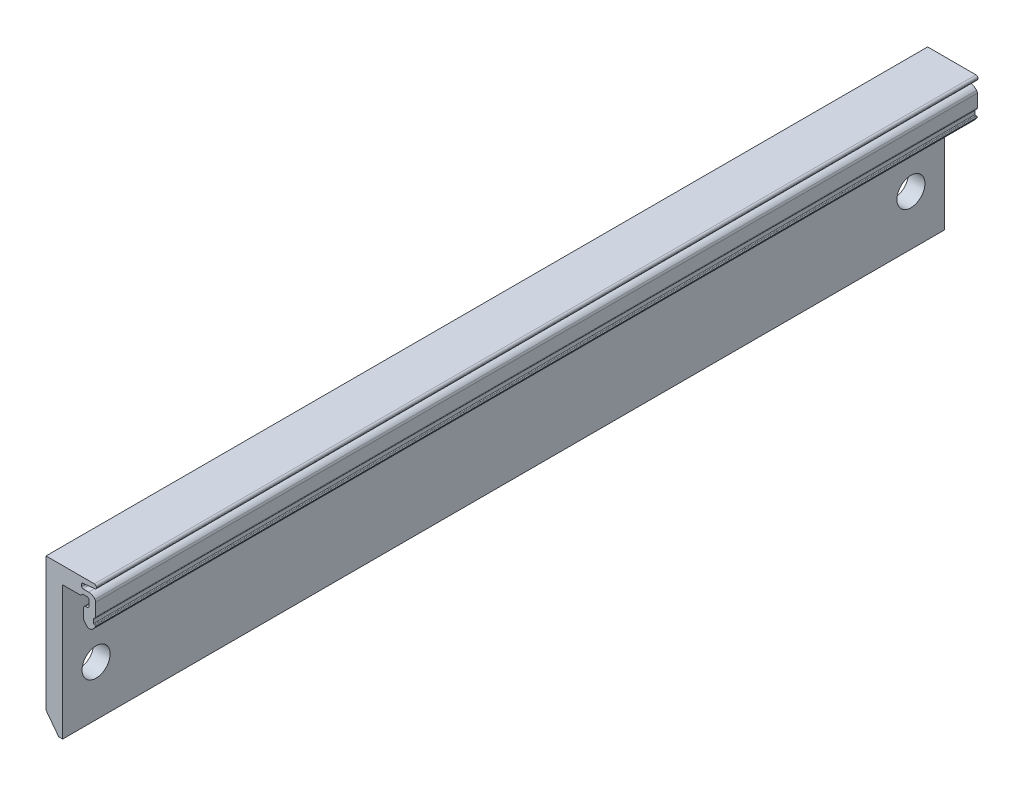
SolidWorks part; units mm, degrees
ref_plane "前视基准面" through (0, 0, 0) normal (0, 0, 1) x (1, 0, 0)
ref_plane "上视基准面" through (0, 0, 0) normal (0, 1, 0) x (1, 0, 0)
ref_plane "右视基准面" through (0, 0, 0) normal (1, 0, 0) x (0, 0, -1)
sketch "草图1" plane through (0, 0, 0) normal (0, 0, 1) x (1, 0, 0)
  line L0 (2350.384, -3290.1038) -> (2355.384, -3290.1038)
  line L2 (2352.884, -3292.6038) -> (2355.384, -3292.6038)
  line L3 (2350.384, -3292.6038) -> (2350.384, -3310.1038)
  line L4 (2352.884, -3292.6038) -> (2352.884, -3312.6038)
  line L5 (2355.384, -3292.6038) -> (2355.384, -3290.1038) construction
  line L6 (2355.384, -3290.1038) -> (2357.924, -3290.1038) construction
  line L7 (2350.384, -3292.6038) -> (2350.384, -3290.1038)
  line L10 (2352.884, -3312.6038) -> (2352.284, -3312.6038)
  line L11 (2350.384, -3310.1038) -> (2352.284, -3312.6038)
  line L12 (2356.524, -3292.3038) -> (2355.988, -3292.3038)
  line L13 (2357.5972, -3295.408) -> (2357.724, -3295.408)
  line L14 (2357.624, -3290.1038) -> (2357.924, -3290.1038) construction
  line L15 (2357.8006, -3295.5917) -> (2357.3831, -3296.0891)
  line L16 (2357.4972, -3294.808) -> (2357.4972, -3295.308)
  line L17 (2357.824, -3295.508) -> (2357.824, -3295.5274)
  line L18 (2357.824, -3292.376) -> (2357.824, -3294.2738)
  line L19 (2356.324, -3293.7038) -> (2356.524, -3293.7038)
  line L20 (2356.024, -3295.4545) -> (2356.024, -3294.0038)
  line L21 (2357.7449, -3290.6914) -> (2355.9031, -3290.8849)
  line L22 (2355.724, -3291.0839) -> (2355.724, -3291.4038)
  line L23 (2355.924, -3291.6038) -> (2356.77, -3291.6038)
  line L24 (2357.924, -3290.4038) -> (2357.924, -3290.4925)
  line L25 (2356.465, -3296.0891) -> (2356.0943, -3295.6474)
  line L26 (2356.824, -3293.4038) -> (2356.824, -3292.6038)
  line L27 (2357.924, -3290.4038) -> (2357.924, -3290.1038) construction
  line L28 (2355.384, -3292.6038) -> (2355.4683, -3292.6038)
  line L29 (2355.384, -3290.1038) -> (2357.624, -3290.1038)
  arc A0 (2357.4972, -3294.808) -> (2357.6606, -3294.5409) centre (2357.7972, -3294.808) cw
  arc A1 (2356.77, -3291.6038) -> (2357.7198, -3292.0704) centre (2356.77, -3292.8038) cw
  arc A2 (2357.824, -3295.5274) -> (2357.8006, -3295.5917) centre (2357.724, -3295.5274) cw
  arc A3 (2355.724, -3291.0839) -> (2355.9031, -3290.8849) centre (2355.924, -3291.0839) cw
  arc A4 (2357.924, -3290.4925) -> (2357.7449, -3290.6914) centre (2357.724, -3290.4925) cw
  arc A5 (2355.7282, -3292.4538) -> (2355.4683, -3292.6038) centre (2355.4683, -3292.3038) cw
  arc A6 (2357.624, -3290.1038) -> (2357.924, -3290.4038) centre (2357.624, -3290.4038) cw
  arc A7 (2357.5972, -3295.408) -> (2357.4972, -3295.308) centre (2357.5972, -3295.308) cw
  arc A8 (2357.824, -3294.2738) -> (2357.6606, -3294.5409) centre (2357.524, -3294.2738) cw
  arc A9 (2355.924, -3291.6038) -> (2355.724, -3291.4038) centre (2355.924, -3291.4038) cw
  arc A10 (2356.524, -3292.3038) -> (2356.824, -3292.6038) centre (2356.524, -3292.6038) cw
  arc A11 (2356.0943, -3295.6474) -> (2356.024, -3295.4545) centre (2356.324, -3295.4545) cw
  arc A12 (2355.7282, -3292.4538) -> (2355.988, -3292.3038) centre (2355.988, -3292.6038) cw
  arc A13 (2357.7198, -3292.0704) -> (2357.824, -3292.376) centre (2357.324, -3292.376) cw
  arc A14 (2356.024, -3294.0038) -> (2356.324, -3293.7038) centre (2356.324, -3294.0038) cw
  arc A15 (2356.824, -3293.4038) -> (2356.524, -3293.7038) centre (2356.524, -3293.4038) cw
  arc A16 (2357.3831, -3296.0891) -> (2356.465, -3296.0891) centre (2356.924, -3295.7038) cw
  arc A17 (2357.724, -3295.408) -> (2357.824, -3295.508) centre (2357.724, -3295.508) cw
  dimension "D1" = 20
  dimension "D2" = 0.6
  dimension "D3" = 2.5
  dimension "D5" = 127.235
extrude "凸台-拉伸1" add sketch "草图1" along normal mid plane 132
sketch "草图3" plane through (2350.384, 0, 0) normal (-1, 0, 0) x (0, 0, 1)
  line L0 (-66, -3290.1038) -> (-66, -3310.1038) construction
  line L1 (66, -3290.1038) -> (-66, -3290.1038) construction
  line L2 (0, -3290.1038) -> (0, -3328.2905) construction
  line L3 (66, -3290.1038) -> (-66, -3290.1038) construction
  circle A0 centre (-61, -3305.1038) radius 2.1
  circle A1 centre (61, -3305.1038) radius 2.1
  dimension "D1" = 4.2
  dimension "D2" = 5
  dimension "D3" = 15
extrude "切除-拉伸1" cut sketch "草图3" against normal through all
